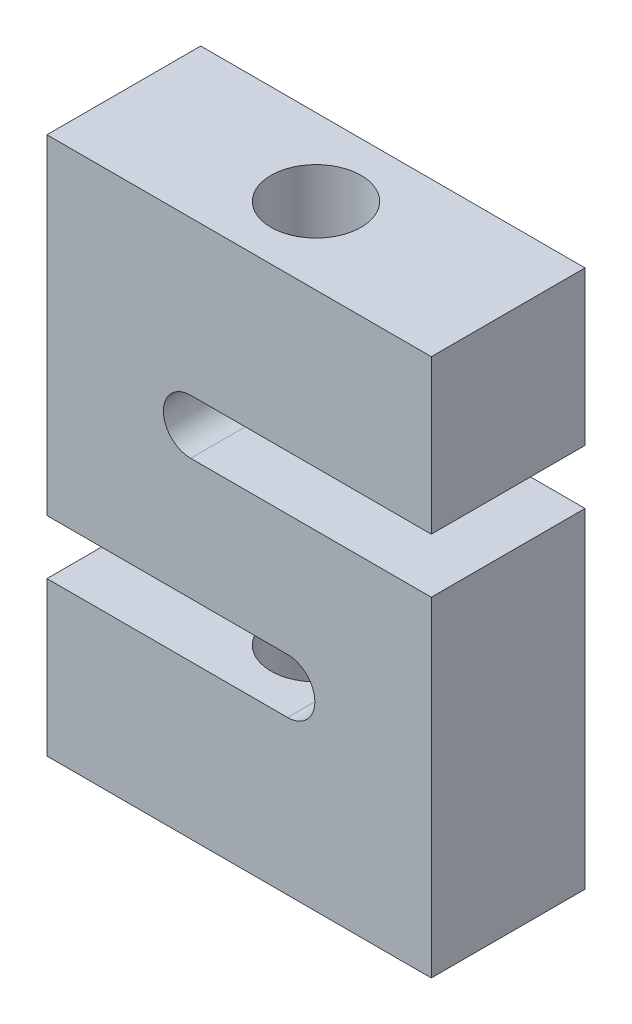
SolidWorks part; units mm, degrees
ref_plane "Front" through (0, 0, 0) normal (0, 0, 1) x (1, 0, 0)
ref_plane "Top" through (0, 0, 0) normal (0, 1, 0) x (1, 0, 0)
ref_plane "Right" through (0, 0, 0) normal (1, 0, 0) x (0, 0, -1)
sketch "Sketch2" plane through (0, 0, 0) normal (0, 0, 1) x (1, 0, 0)
  line L0 (-115.7484, 0) -> (180.4341, 0) construction
  line L1 (-63.5, 88.9) -> (63.5, 88.9)
  line L2 (-63.5, 88.9) -> (-63.5, -20.066)
  line L3 (-63.5, -88.9) -> (63.5, -88.9)
  line L4 (63.5, 88.9) -> (63.5, 38.1)
  line L5 (-63.5, 88.9) -> (63.5, -88.9) construction
  line L6 (-63.5, -88.9) -> (63.5, 88.9) construction
  line L7 (63.5, 38.1) -> (-16.002, 38.1)
  line L8 (-63.5, -20.066) -> (16.002, -20.066)
  line L9 (63.5, 20.066) -> (-16.002, 20.066)
  line L10 (-16.002, 38.1) -> (-16.002, 20.066) construction
  line L11 (63.5, 38.1) -> (-16.002, 20.066) construction
  line L12 (63.5, 20.066) -> (-16.002, 38.1) construction
  line L13 (63.5, 20.066) -> (63.5, -88.9)
  line L14 (16.002, -20.066) -> (16.002, -38.1) construction
  line L15 (16.002, -38.1) -> (-63.5, -38.1)
  line L16 (-63.5, -38.1) -> (-63.5, -88.9)
  arc A0 (16.002, -38.1) -> (16.002, -20.066) centre (16.002, -29.083) ccw
  arc A1 (-16.002, 38.1) -> (-16.002, 20.066) centre (-16.002, 29.083) ccw
  point P0 (0, 0)
  point P10 (23.749, 29.083)
  dimension "D1" = 127
  dimension "D2" = 177.8
  dimension "D3" = 50.8
  dimension "D4" = 18.034
  dimension "D5" = 79.502
  dimension "D6" = 79.502
  dimension "D7" = 50.8
  dimension "D8" = 18.034
extrude "Boss-Extrude1" add sketch "Sketch2" along normal mid plane 50.8
hole_wizard "1-1/4-12 Tapped Hole1" positions "Sketch3" profile "Sketch4" tap size "1-1/4-12" standard "ANSI Inch"
sketch "Sketch3" plane through (0, 88.9, 0) normal (0, 1, 0) x (1, 0, 0)
  point P0 (0, 0)
sketch "Sketch4" plane through (0, 88.9, 0) normal (1, 0, 0) x (0, 0, 1)
  line L0 (0, 0) -> (0, 108.966)
  line L1 (0, 108.966) -> (14.8831, 108.966)
  line L2 (14.8831, 108.966) -> (14.8831, 0)
  line L5 (14.8831, 0) -> (0, 0)
  line L11 (0, -6.35) -> (0, 107.95) construction
  dimension "Thru Tap Drill Dia." = 29.7663
  dimension "Thru Tap Drill Depth" = 108.966
mirror "Mirror1" about plane through (0, 0, 0) normal (0, 1, 0) of "1-1/4-12 Tapped Hole1"
